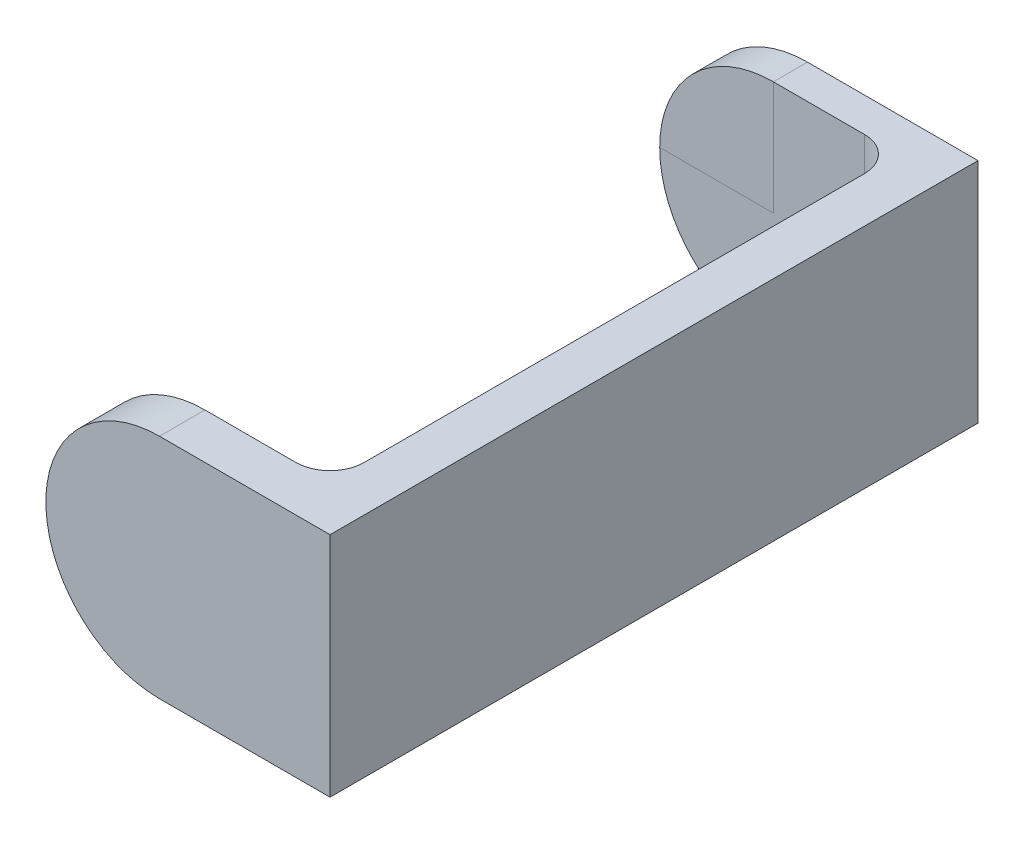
SolidWorks part; units mm, degrees
ref_plane "Front Plane" through (0, 0, 0) normal (0, 0, 1) x (1, 0, 0)
ref_plane "Top Plane" through (0, 0, 0) normal (0, 1, 0) x (1, 0, 0)
ref_plane "Right Plane" through (0, 0, 0) normal (1, 0, 0) x (0, 0, -1)
ref_plane "Plane1" through (0, 0, 500) normal (0, 0, 1) x (1, 0, 0)
ref_plane "Plane3" through (0, 0, -500) normal (0, 0, 1) x (1, 0, 0)
sketch "Sketch2" plane through (0, 0, 500) normal (0, 0, 1) x (1, 0, 0)
  line L0 (0, 0) -> (421.1494, 0) construction
  line L1 (0, -200) -> (300, -200)
  line L3 (0, 200) -> (300, 200)
  line L4 (300, -200) -> (300, 200)
  arc A0 (0, 200) -> (0, -200) centre (0, 0) ccw
  dimension "D1" = 400
  dimension "D2" = 300
extrude "Extrude1" add sketch "Sketch2" along normal blind 80
sketch "Sketch3" plane through (0, 0, -500) normal (0, 0, 1) x (1, 0, 0)
  line L3 (300, 200) -> (0, 200)
  line L4 (300, -200) -> (300, 200)
  line L5 (0, -200) -> (300, -200)
  line L6 (300, 200) -> (0, 200)
  line L7 (300, -200) -> (300, 200)
  line L8 (0, -200) -> (300, -200)
  arc A1 (0, 200) -> (0, -200) centre (0, 0) ccw
  arc A2 (0, 200) -> (0, -200) centre (0, 0) ccw
  dimension "D1" = 0
extrude "Extrude2" add sketch "Sketch3" against normal blind 60
sketch "Sketch4" plane through (0, 0, -500) normal (0, 0, 1) x (1, 0, 0)
  line L0 (300, 200) -> (0, 200) construction
  line L1 (300, -200) -> (220, -200)
  line L2 (300, -200) -> (300, 200)
  line L3 (300, 200) -> (220, 200)
  line L4 (220, -200) -> (220, 200)
  dimension "D1" = 80
extrude "Extrude3" add sketch "Sketch4" along normal up to next
sketch "Sketch5" plane through (0, 0, 0) normal (0, 0, 1) x (1, 0, 0)
  line L0 (0, 0) -> (-200, 0)
  line L1 (0, 0) -> (0, 200)
  arc A0 (0, 200) -> (0, -200) centre (0, 0) ccw construction
  arc A1 (0, 200) -> (-200, 0) centre (0, 0) ccw
fillet "Fillet1" radius 60 2 edges
